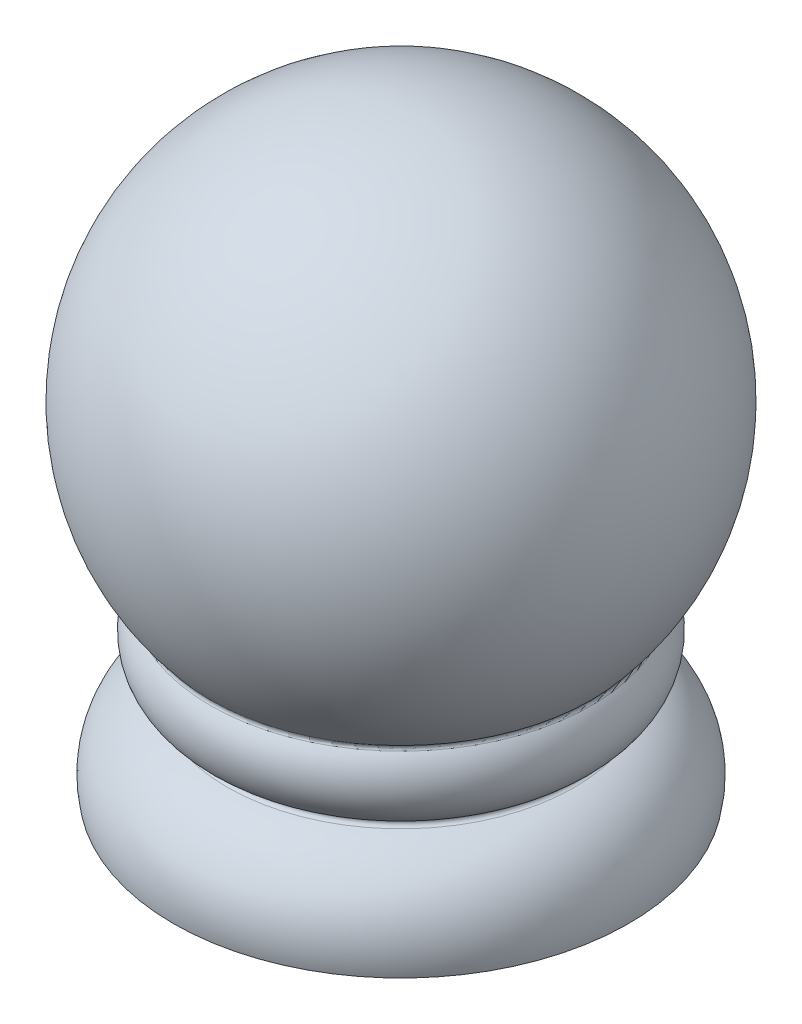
SolidWorks part; units mm, degrees
ref_plane "Plane1" through (0, 0, 0) normal (0, 0, 1) x (1, 0, 0)
ref_plane "Plane2" through (0, 0, 0) normal (0, 1, 0) x (1, 0, 0)
ref_plane "Plane3" through (0, 0, 0) normal (1, 0, 0) x (0, 0, -1)
sketch "Sketch1" plane through (0, 0, 0) normal (0, 0, 1) x (1, 0, 0)
  line L0 (0, 77.2442) -> (0, -46.8583) construction
  line L1 (0, 0) -> (14.5, 0)
  line L2 (0, 37.583) -> (0, 0)
  arc A0 (14.5, 0) -> (11.0578, 5.7997) centre (9.6042, 1.0157) ccw
  arc A1 (11.0259, 6.2661) -> (12.1322, 10.8428) centre (9.7717, 8.9913) ccw
  arc A2 (11.0259, 6.2661) -> (11.0578, 5.7997) centre (11.1305, 6.039) ccw
  arc A3 (0, 37.583) -> (12.1392, 11.16) centre (0, 21.583) cw
  arc A4 (12.1392, 11.16) -> (12.1322, 10.8428) centre (12.3289, 10.9971) ccw
  point P11 (10, 6)
  point P16 (12, 11)
  dimension "D4" = 5
  dimension "D7" = 3
  dimension "D8" = 0.25
  dimension "D9" = 16
  dimension "D10" = 0.25
  dimension "D1" = 14.5
  dimension "D2" = 10
  dimension "D3" = 6
  dimension "D5" = 12
  dimension "D6" = 5
revolve "Base-Revolve" add sketch "Sketch1" angle 360 about L0
sketch "Sketch4" plane through (0, 0, 0) normal (0, 0, 1) x (1, 0, 0)
  line L0 (13.5, -1.8614) -> (13.5, 2)
  line L1 (13.5, 2) -> (12.5, 2)
  line L2 (12.5, 2) -> (10, 6)
  line L3 (10, 6) -> (10, 30)
  line L4 (10, 30) -> (0, 30)
  line L5 (0, 77.2442) -> (0, -46.8583) construction
  line L6 (0, 30) -> (0, -1.8614)
  line L7 (0, 39.3418) -> (0, -12.3309) construction
  line L8 (0, -1.8614) -> (13.5, -1.8614)
  dimension "D1" = 2
  dimension "D2" = 13.5
  dimension "D3" = 1
  dimension "D4" = 10
  dimension "D5" = 6
  dimension "D6" = 30
revolve "Cut-Revolve1" cut sketch "Sketch4" angle 360 about L7
sketch "Sketch5" plane through (0, 30, 0) normal (0, -1, 0) x (1, 0, 0)
  circle A0 centre (0, 0) radius 4.5
  dimension "D1" = 9
extrude "Boss-Extrude1" add sketch "Sketch5" along normal blind 6 draft 1
sketch "Sketch6" plane through (0, 24, 0) normal (0, -1, 0) x (1, 0, 0)
  circle A0 centre (0, 0) radius 3.25
  dimension "D1" = 6.5
extrude "Cut-Extrude2" cut sketch "Sketch6" against normal blind 10
fillet "Fillet1" radius 0.25 2 edges at (0, 2, 12.5) (0, 24, -4.3953)
fillet "Fillet2" radius 2 1 edges at (0, 30, 10)
